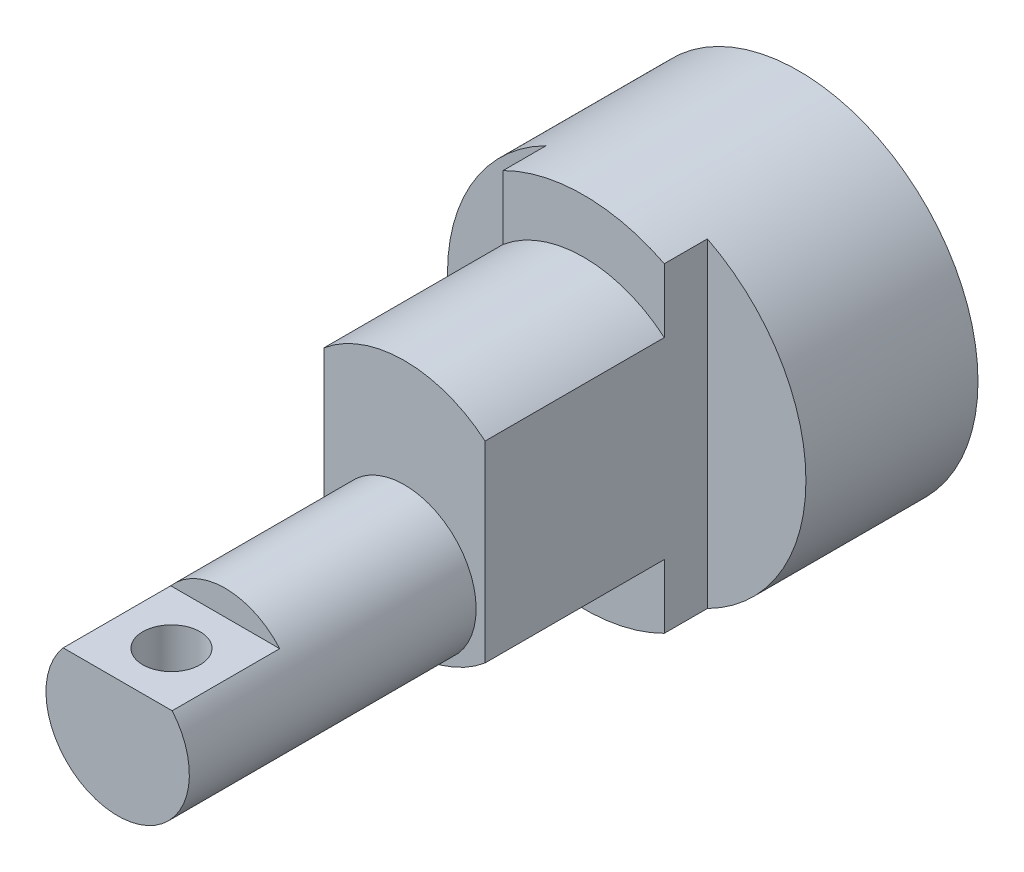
SolidWorks part; units mm, degrees
ref_plane "前视基准面" through (0, 0, 0) normal (0, 0, 1) x (1, 0, 0)
ref_plane "上视基准面" through (0, 0, 0) normal (0, 1, 0) x (1, 0, 0)
ref_plane "右视基准面" through (0, 0, 0) normal (1, 0, 0) x (0, 0, -1)
sketch "草图1" plane through (0, 0, 0) normal (0, 0, 1) x (1, 0, 0)
  circle A0 centre (0, 0) radius 50
  dimension "D1" = 100
extrude "拉伸1" add sketch "草图1" along normal blind 60
sketch "草图2" plane through (0, 0, 60) normal (0, 0, 1) x (1, 0, 0)
  circle A0 centre (0, 0) radius 35
  dimension "D1" = 70
extrude "拉伸2" add sketch "草图2" along normal blind 50
sketch "草图3" plane through (0, 0, 110) normal (0, 0, 1) x (1, 0, 0)
  circle A0 centre (0, -15) radius 20
  circle A1 centre (0, 0) radius 35 construction
  dimension "D1" = 40
extrude "拉伸3" add sketch "草图3" along normal blind 80
ref_plane "基准面1" through (0, 10, 0) normal (0, 1, 0) x (-1, 0, 0)
sketch "草图4" plane through (0, 10, 0) normal (0, 1, 0) x (1, 0, 0)
  line L0 (0, 0) -> (0, -199.8062) construction
  line L1 (-20, -190) -> (-20, -160)
  line L2 (-20, -190) -> (20, -190) construction
  line L3 (-20, -160) -> (20, -160)
  line L4 (20, -160) -> (20, -190)
  line L5 (20, -190) -> (-20, -190)
  dimension "D1" = 40
  dimension "D2" = 30
extrude "切除-拉伸1" cut sketch "草图4" against normal blind 12
sketch "草图5" plane through (0, -2, 0) normal (0, 1, 0) x (1, 0, 0)
  line L0 (0, -190) -> (0, -135.3206) construction
  line L1 (-15.1987, -190) -> (15.1987, -190) construction
  line L2 (15.1987, -175) -> (-15.1987, -175) construction
  line L3 (15.1987, -160) -> (15.1987, -190) construction
  line L4 (-15.1987, -190) -> (-15.1987, -160) construction
  circle A0 centre (0, -175) radius 8
  dimension "D1" = 16
extrude "切除-拉伸2" cut sketch "草图5" against normal through all
ref_plane "基准面2" through (0, 0, 48) normal (0, 0, 1) x (1, 0, 0)
sketch "草图6" plane through (0, 0, 48) normal (0, 0, 1) x (1, 0, 0)
  line L0 (0, -64.3133) -> (0, 63.6316) construction
  line L1 (22.5, -44.6514) -> (22.5, 44.6514)
  line L2 (-22.5, 44.6514) -> (-22.5, -44.6514)
  arc A0 (-22.5, 44.6514) -> (-22.5, -44.6514) centre (0, 0) ccw
  arc A1 (22.5, -44.6514) -> (22.5, 44.6514) centre (0, 0) ccw
  dimension "D1" = 100
  dimension "D2" = 45
extrude "切除-拉伸3" cut sketch "草图6" along normal through all
